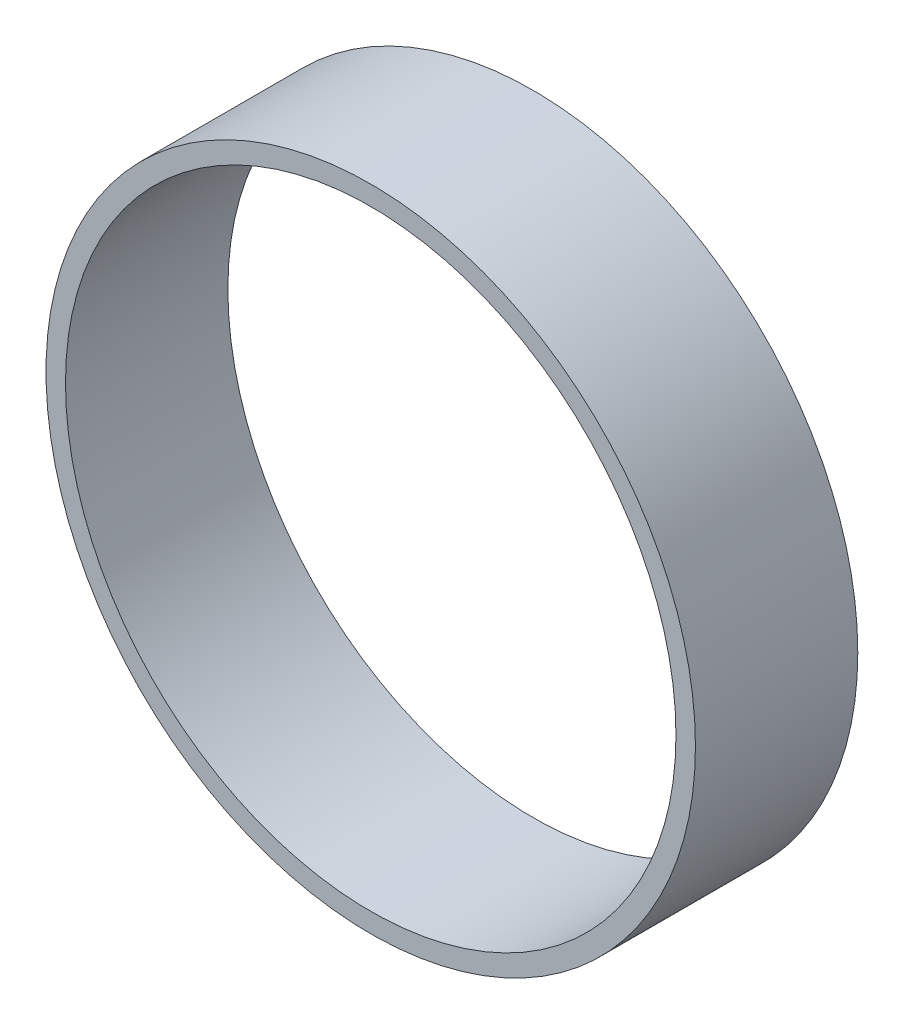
SolidWorks part; units mm, degrees
ref_plane "Plan de face" through (0, 0, 0) normal (0, 0, 1) x (1, 0, 0)
ref_plane "Plan de dessus" through (0, 0, 0) normal (0, 1, 0) x (1, 0, 0)
ref_plane "Plan de droite" through (0, 0, 0) normal (1, 0, 0) x (0, 0, -1)
sketch "Esquisse1" plane through (0, 0, 0) normal (0, 0, 1) x (1, 0, 0)
  circle A0 centre (0, 0) radius 50
  circle A1 centre (0, 0) radius 47
  dimension "D1" = 100
  dimension "D2" = 3
extrude "Boss.-Extru.1" add sketch "Esquisse1" along normal blind 25
